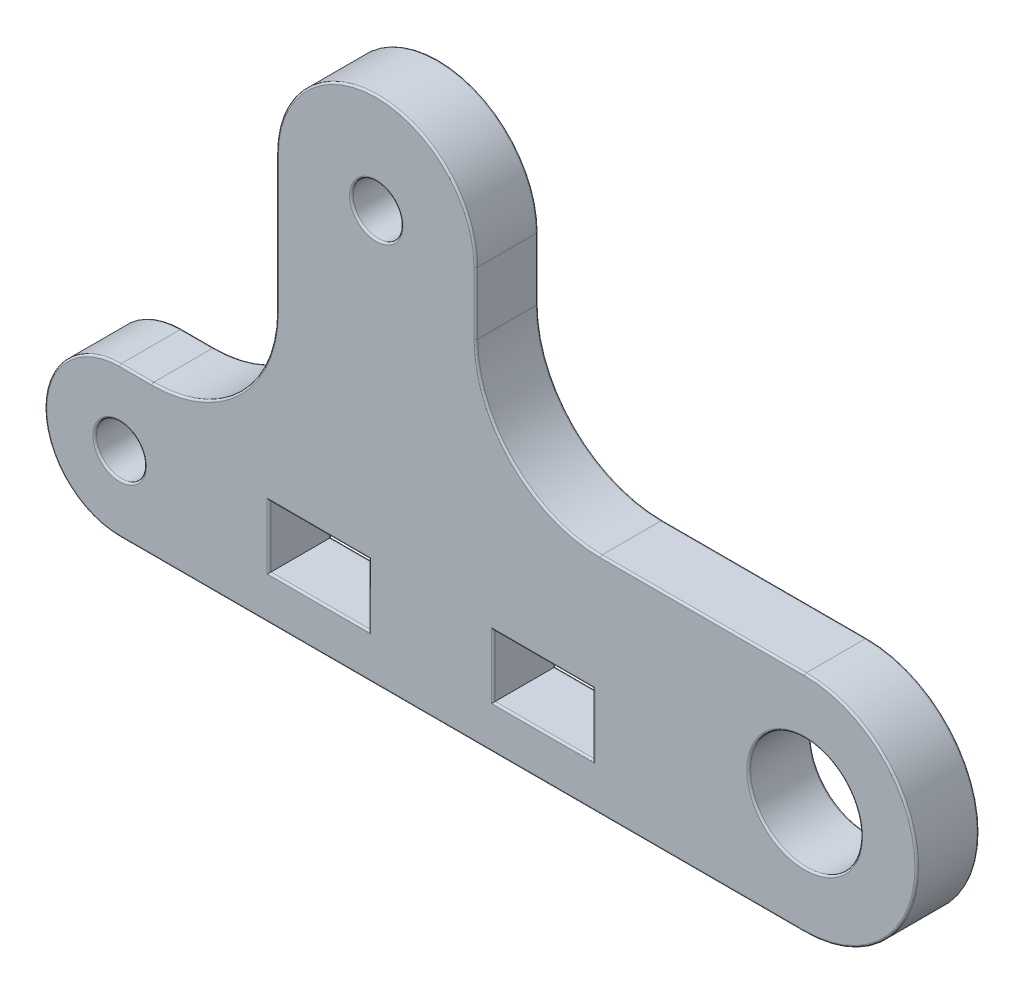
SolidWorks part; units mm, degrees
ref_plane "Front Plane" through (0, 0, 0) normal (0, 0, 1) x (1, 0, 0)
ref_plane "Top Plane" through (0, 0, 0) normal (0, 1, 0) x (1, 0, 0)
ref_plane "Right Plane" through (0, 0, 0) normal (1, 0, 0) x (0, 0, -1)
sketch "Sketch1" plane through (0, 0, 0) normal (0, 0, 1) x (1, 0, 0)
  line L0 (-27.5, 0) -> (27.5, 0)
  line L1 (-14.9, 33) -> (-14.9, 22)
  line L2 (-24.9, 12) -> (-27.5, 12)
  line L3 (1.1, 33) -> (1.1, 28)
  line L4 (11.1, 18) -> (27.5, 18)
  line L5 (-27.5, 6) -> (-15.5, 6) construction
  line L7 (-15.5, 3.5) -> (-7.5, 3.5)
  line L8 (-15.5, 3.5) -> (-15.5, 8.5)
  line L9 (-15.5, 8.5) -> (-7.5, 8.5)
  line L10 (-7.5, 3.5) -> (-7.5, 8.5)
  line L11 (2.5, 8.5) -> (10.5, 8.5)
  line L12 (2.5, 8.5) -> (2.5, 3.5)
  line L13 (2.5, 3.5) -> (10.5, 3.5)
  line L14 (10.5, 8.5) -> (10.5, 3.5)
  arc A0 (27.5, 0) -> (27.5, 18) centre (27.5, 9) ccw
  arc A1 (-27.5, 0) -> (-27.5, 12) centre (-27.5, 6) cw
  circle A2 centre (-27.5, 6) radius 2
  circle A3 centre (27.5, 9) radius 4.5
  circle A4 centre (-6.9, 33) radius 2
  circle A5 centre (-6.9, 33) radius 8 construction
  arc A6 (1.1, 28) -> (11.1, 18) centre (11.1, 28) ccw
  arc A7 (-14.9, 22) -> (-24.9, 12) centre (-24.9, 22) cw
  arc A8 (-14.9, 33) -> (1.1, 33) centre (-6.9, 33) cw
  point P3 (0, 0)
  dimension "D2" = 9
  dimension "D3" = 6
  dimension "D4" = 9
  dimension "D5" = 4
  dimension "D8" = 16
  dimension "D9" = 10
  dimension "D1" = 55
  dimension "D6" = 33
  dimension "D7" = 6.9
  dimension "D10" = 8
  dimension "D11" = 5
  dimension "D12" = 12
  dimension "D13" = 10
extrude "Boss-Extrude1" add sketch "Sketch1" along normal mid plane 5
fillet "Fillet1" radius 0.15 42 edges at (10.5, 6, -2.5) (6.5, 3.5, -2.5) (2.5, 6, -2.5) (6.5, 8.5, -2.5) (-7.5, 6, -2.5) (-11.5, 3.5, -2.5) (-15.5, 6, -2.5) (-11.5, 8.5, -2.5) (-4.9, 33, -2.5) (32, 9, -2.5) (0, 0, -2.5) (36.5, 9, -2.5) (19.3, 18, -2.5) (4.0289, 20.9289, -2.5) (1.1, 30.5, -2.5) (-6.9, 41, -2.5) (-14.9, 27.5, -2.5) (-17.8289, 14.9289, -2.5) (-26.2, 12, -2.5) (-33.5, 6, -2.5) (-25.5, 6, -2.5) (6.5, 3.5, 2.5) (10.5, 6, 2.5) (6.5, 8.5, 2.5) (2.5, 6, 2.5) (-4.9, 33, 2.5) (-25.5, 6, 2.5) (32, 9, 2.5) (-26.2, 12, 2.5) (-17.8289, 14.9289, 2.5) (-14.9, 27.5, 2.5) (-6.9, 41, 2.5) (1.1, 30.5, 2.5) (4.0289, 20.9289, 2.5) (19.3, 18, 2.5) (36.5, 9, 2.5) (0, 0, 2.5) (-33.5, 6, 2.5) (-11.5, 3.5, 2.5) (-7.5, 6, 2.5) (-11.5, 8.5, 2.5) (-15.5, 6, 2.5)
